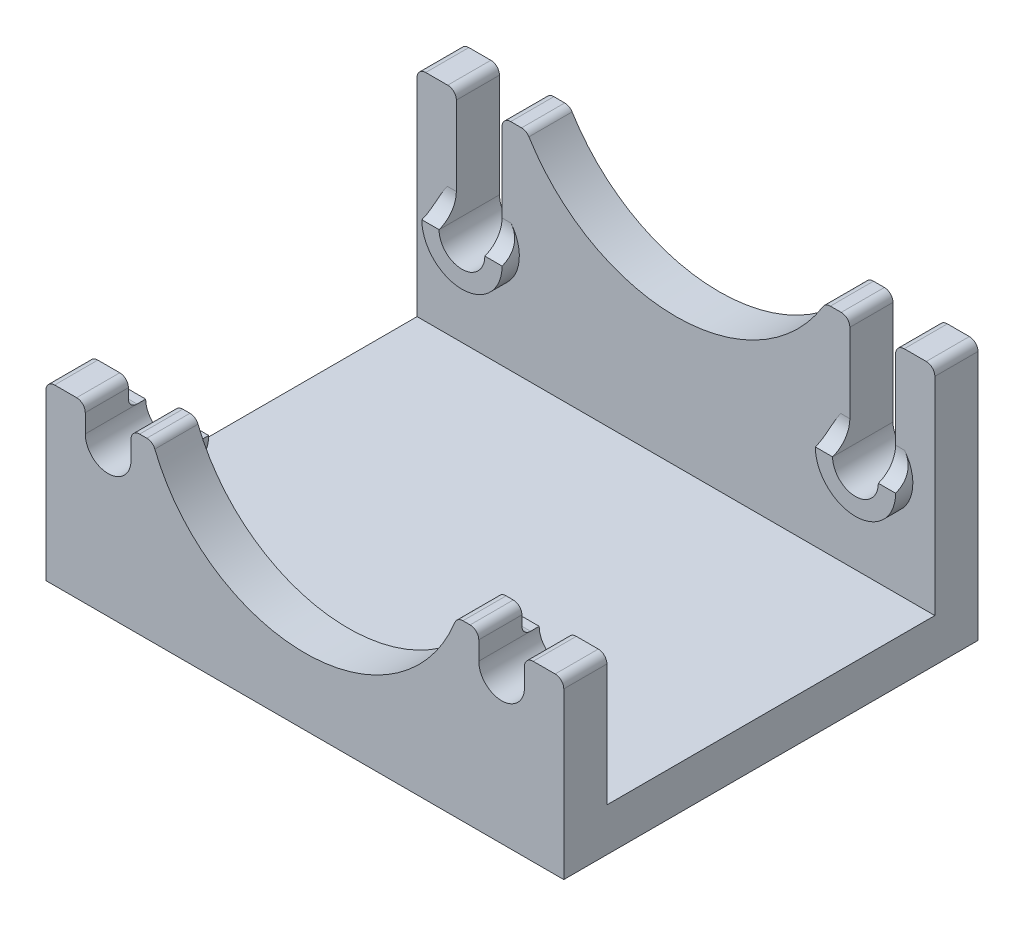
SolidWorks part; units mm, degrees
ref_plane "Front Plane" through (0, 0, 0) normal (0, 0, 1) x (1, 0, 0)
ref_plane "Top Plane" through (0, 0, 0) normal (0, 1, 0) x (1, 0, 0)
ref_plane "Right Plane" through (0, 0, 0) normal (1, 0, 0) x (0, 0, -1)
sketch "Esquisse1" plane through (0, 0, 0) normal (0, 0, 1) x (1, 0, 0)
  line L0 (-30, 0) -> (-30, 30)
  line L1 (-30, 0) -> (30, 0)
  line L2 (30, 0) -> (30, 30)
  line L3 (0, 0) -> (0, 46.0342) construction
  line L4 (-30, 30) -> (-17.3205, 30)
  line L5 (17.3205, 30) -> (30, 30)
  arc A0 (-17.3205, 30) -> (17.3205, 30) centre (0, 40) ccw
  dimension "D3" = 20
  dimension "D1" = 30
  dimension "D2" = 60
  dimension "D4" = 40
extrude "Boss.-Extru.1" add sketch "Esquisse1" along normal mid plane 48
sketch "Esquisse2" plane through (30, 0, 0) normal (1, 0, 0) x (0, 0, -1)
  line L0 (0, 0) -> (0, 25.3668) construction
  line L1 (-19, 32.4113) -> (19, 32.4113)
  line L2 (-19, 32.4113) -> (-19, 5)
  line L3 (-19, 5) -> (19, 5)
  line L4 (19, 32.4113) -> (19, 5)
  line L5 (-24, 0) -> (-24, 30) construction
  line L6 (-24, 0) -> (24, 0) construction
  dimension "D1" = 5
  dimension "D2" = 5
extrude "Enlèv. mat.-Extru.1" cut sketch "Esquisse2" against normal through all
sketch "Esquisse3" plane through (0, 0, 24) normal (0, 0, 1) x (1, 0, 0)
  line L0 (-22.8, 41.2809) -> (-22.8, 17) construction
  line L1 (-20.15, 41.2809) -> (-20.15, 17)
  line L2 (-25.45, 41.2809) -> (-25.45, 17)
  line L3 (-30, 0) -> (30, 0) construction
  line L4 (-30, 30) -> (-30, 0) construction
  arc A0 (-20.15, 41.2809) -> (-25.45, 41.2809) centre (-22.8, 41.2809) ccw
  arc A1 (-25.45, 17) -> (-20.15, 17) centre (-22.8, 17) ccw
  point P2 (-22.8, 29.1405)
  dimension "D1" = 2.65
  dimension "D2" = 17
  dimension "D3" = 7.2
extrude "Enlèv. mat.-Extru.2" cut sketch "Esquisse3" against normal through all
mirror "Symétrie1" about plane through (0, 0, 0) normal (1, 0, 0) of "Enlèv. mat.-Extru.2"
sketch "Esquisse4" plane through (0, 0, 24) normal (0, 0, 1) x (1, 0, 0)
  line L0 (0, 0) -> (0, 37.1526) construction
  line L1 (17.6263, 20.1385) -> (21.583, 20.1385)
  line L2 (-21.5231, 32.6561) -> (21.583, 32.6561)
  line L3 (-21.5231, 32.6561) -> (-21.5231, 20.1385)
  line L4 (-21.5231, 20.1385) -> (-17.6263, 20.1385)
  line L5 (21.583, 32.6561) -> (21.583, 20.1385)
  line L7 (-24.221, 20.1385) -> (-34.4129, 20.1385)
  line L8 (-24.221, 20.1385) -> (-24.221, 34.8535)
  line L9 (-24.221, 34.8535) -> (-34.4129, 34.8535)
  line L10 (-34.4129, 20.1385) -> (-34.4129, 34.8535)
  line L11 (23.6214, 20.1385) -> (31.8949, 20.1385)
  line L12 (23.6214, 20.1385) -> (23.6214, 32.6561)
  line L13 (23.6214, 32.6561) -> (31.8949, 32.6561)
  line L14 (31.8949, 20.1385) -> (31.8949, 32.6561)
  arc A0 (-17.6263, 20.1385) -> (17.6263, 20.1385) centre (0, 26.4601) ccw
extrude "Enlèv. mat.-Extru.3" cut sketch "Esquisse4" against normal blind 6
sketch "Esquisse5" plane through (0, 0, -19) normal (0, 0, 1) x (1, 0, 0)
  line L0 (-27.45, 17) -> (-25.45, 17)
  line L1 (-20.15, 17) -> (-18.15, 17)
  arc A0 (-25.45, 17) -> (-20.15, 17) centre (-22.8, 17) ccw construction
  arc A1 (-25.45, 17) -> (-20.15, 17) centre (-22.8, 17) ccw
  arc A2 (-27.45, 17) -> (-18.15, 17) centre (-22.8, 17) ccw
  dimension "D1" = 2
extrude "Boss.-Extru.2" add sketch "Esquisse5" along normal blind 2
fillet "Congé2" radius 3 2 edges at (-19.15, 17, -19) (-26.45, 17, -19)
mirror "Symétrie2" about plane through (0, 0, 0) normal (1, 0, 0) of "Congé2", "Boss.-Extru.2"
mirror "Symétrie6" about plane through (0, 0, 0) normal (0, 0, 1) of "Boss.-Extru.2"
mirror "Symétrie7" about plane through (0, 0, 0) normal (1, 0, 0) of "Symétrie6"
fillet "Congé3" radius 1 4 edges at (-19.15, 17, 19) (19.15, 17, 19) (26.45, 17, 19) (-26.45, 17, 19)
fillet "Congé4" radius 1 16 edges at (20.15, 20.1385, 21.5) (17.6263, 20.1385, 21.5) (-17.6263, 20.1385, 21.5) (-20.15, 20.1385, 21.5) (30, 20.1385, 21.5) (25.45, 20.1385, 21.5) (-30, 20.1385, 21.5) (-25.45, 20.1385, 21.5) (30, 30, -21.5) (25.45, 30, -21.5) (20.15, 30, -21.5) (17.3205, 30, -21.5) (-17.3205, 30, -21.5) (-30, 30, -21.5) (-20.15, 30, -21.5) (-25.45, 30, -21.5)
